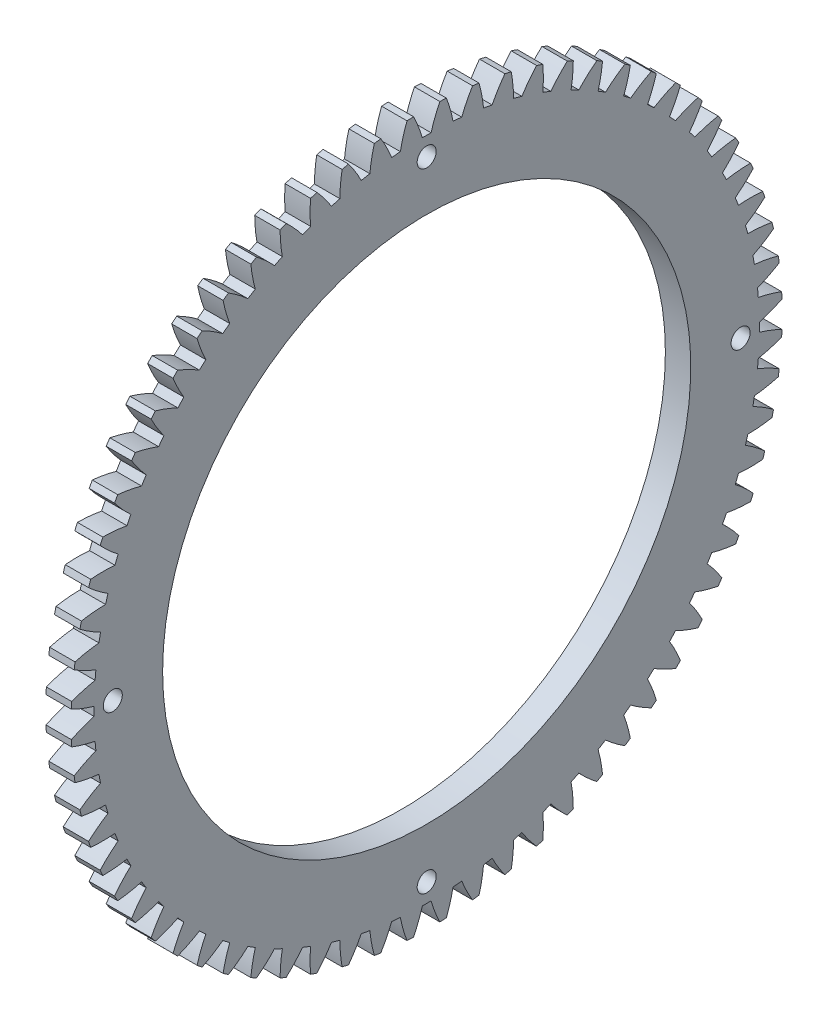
SolidWorks part; units mm, degrees
ref_plane "Plane1" through (0, 0, 0) normal (0, 0, 1) x (1, 0, 0)
ref_plane "Plane2" through (0, 0, 0) normal (0, 1, 0) x (1, 0, 0)
ref_plane "Plane3" through (0, 0, 0) normal (1, 0, 0) x (0, 0, -1)
sketch "HoldingSke" plane through (0, 0, 0) normal (0, 1, 0) x (1, 0, 0)
  line L0 (0, 0) -> (95.1501, -235.5047)
  line L1 (-15, 0) -> (100, 0) construction
  line L2 (0, 0) -> (-2.1039, 2.3779)
  line L3 (0, 0) -> (-11.863, 4.5341)
  line L4 (0, 0) -> (3.2351, 8.0072)
  line L5 (0, 0) -> (-47.5972, -17.7524)
  line L6 (0, 0) -> (-5.2639, -3.5516)
  line L7 (-2.1039, 2.3779) -> (8.8308, 51.9871)
  line L8 (-76.2, 54.61) -> (92.964, 54.61)
  line L9 (-71.009, 38.7566) -> (-53.1078, 45.2721)
  line L10 (-76.2, 71.12) -> (104.1128, 71.12)
  line L11 (0, 0) -> (-6.35, 0)
  line L12 (-76.2, 101.6) -> (-76.0984, 101.6)
  line L13 (24.9733, 27.94) -> (52.9518, 28.4284)
  line L14 (24.9733, 27.94) -> (24.9746, 27.94)
  line L15 (24.9733, 27.94) -> (100.4006, 29.5858)
  circle A0 centre (0, 0) radius 76.2
  circle A1 centre (0, 0) radius 38.1
  circle A2 centre (0, 0) radius 38.1
  circle A3 centre (0, 0) radius 76.2
sketch "BasProSke" plane through (0, 0, 0) normal (0, 1, 0) x (1, 0, 0)
  line L0 (-10, 0) -> (60, 0) construction
  line L1 (0, 0) -> (0, 88.9)
  line L2 (0, 0) -> (6.35, 0)
  line L3 (6.35, 0) -> (6.35, 88.9)
  line L4 (6.35, 88.9) -> (0, 88.9)
revolve "Base-Revolve" add sketch "BasProSke" angle 360 about L0
sketch "TooCutSke" plane through (0, 0, 0) normal (1, 0, 0) x (0, 0, -1)
  line L1 (0, 0) -> (0, 107) construction
  line L2 (0, 0) -> (-2.1725, 86.3327) construction
  line L3 (0, 0) -> (-7.975, 172.4975) construction
  line L4 (-2.1725, 86.3327) -> (-3.9875, 86.2488) construction
  arc A0 (1.0901, 83.1766) -> (-1.0901, 83.1766) centre (0, 0) ccw
  arc A1 (3.2994, 88.8642) -> (-3.2994, 88.8642) centre (0, 0) ccw
  circle A2 centre (0, 0) radius 86.36 construction
  circle A3 centre (0, 0) radius 81.1519 construction
  arc A4 (-1.0901, 83.1766) -> (-3.2994, 88.8642) centre (-34.2689, 73.5613) ccw
  arc A5 (3.2994, 88.8642) -> (1.0901, 83.1766) centre (34.2689, 73.5613) ccw
extrude "ToothCut" cut sketch "TooCutSke" along normal through all
fillet "Breaks" [suppressed] radius 0.0508
fillet "RootFillets" [suppressed] radius 0.6363
pattern_circular "TeethCuts" count 68 every 5.294 about axis through (-10, 0, 0) along (1, 0, 0) of "ToothCut", "RootFillets", "Breaks"
sketch "HubNeaOneSke" plane through (0, 0, 0) normal (-1, 0, 0) x (0, 0, 1)
  circle A0 centre (0, 0) radius 38.1
extrude "HubNearOne" [suppressed] add sketch "HubNeaOneSke" along normal blind 44.4501
sketch "HubNeaBotSke" plane through (0, 0, 0) normal (-1, 0, 0) x (0, 0, 1)
  circle A0 centre (0, 0) radius 38.1
extrude "HubNearBoth" [suppressed] add sketch "HubNeaBotSke" along normal blind 22.225
ref_plane "FarPln" through (6.35, 0, 0) normal (1, 0, 0) x (0, 0, -1)
sketch "HubFarSke" plane through (6.35, 0, 0) normal (1, 0, 0) x (0, 0, -1)
  circle A0 centre (0, 0) radius 38.1
extrude "HubFar" [suppressed] add sketch "HubFarSke" along normal blind 22.225
sketch "BorSke" plane through (0, 0, 0) normal (1, 0, 0) x (0, 0, -1)
  circle A0 centre (0, 0) radius 66.04
  dimension "D1" = 132.08
extrude "Bore" cut sketch "BorSke" along normal mid plane 101.6001
sketch "KeySke" plane through (0, 0, 0) normal (1, 0, 0) x (0, 0, -1)
  line L0 (-19.05, 0) -> (-19.05, 92.964)
  line L1 (-19.05, 92.964) -> (19.05, 92.964)
  line L2 (19.05, 92.964) -> (19.05, 0)
  line L3 (0, 0) -> (0, 34) construction
  line L4 (-19.05, 0) -> (19.05, 0)
extrude "Keyway" [suppressed] cut sketch "KeySke" along normal mid plane 101.6001
pattern_circular "Keyway2" [suppressed] count 2 every 90 about axis through (-10, 0, 0) along (1, 0, 0)
sketch "Sketch2" plane through (6.35, 0, 0) normal (1, 0, 0) x (0, 0, -1)
  line L0 (0, 78.5) -> (0, 0) construction
  line L7 (78.5, 0) -> (0, 0) construction
  circle A0 centre (0, 0) radius 85.5 construction
  circle A1 centre (0, 78.5) radius 2.3812
  circle A2 centre (78.5, 0) radius 2.3813
  circle A3 centre (0, -78.5) radius 2.3813
  circle A4 centre (-78.5, 0) radius 2.3813
  point P3 (6.9506, -0.2673)
  point P4 (0, 0)
  point P5 (0, 0)
  point P18 (0, 0)
  dimension "D1" = 171
  dimension "D4" = 4.7625
  dimension "D5" = 78.5
  dimension "D6" = 4
extrude "Cut-Extrude1" cut sketch "Sketch2" against normal through all contours A4 | A3 | A2 | A1
equation "' \"Pitch@HoldingSke\" = 4"
equation "' \"Num_teeth@HoldingSke\" = 12"
equation "' \"Ap@HoldingSke\" =  20"
equation "' \"Ap@HoldingSke\" = 20"
equation "' \"Width@HoldingSke\" = 0.5"
equation "' \"Hub_dia@HoldingSke\"= 1"
equation "' \"Hub_dia@HoldingSke\" = 1"
equation "' \"Overall_len@HoldingSke\" = 1.0"
equation "' \"Bore@HoldingSke\" = 0.75"
equation "' \"T_dim@HoldingSke\" = 0.85"
equation "' \"Width@KeySke\" = 0.25"
equation "' \"Show_teeth@HoldingSke\" = 13"
equation "' \"Backlash@HoldingSke\" = 0.009"
equation "' \"Addendum_fac@HoldingSke\" = 1.0"
equation "' \"Dedendum_fac@HoldingSke\" = 1.25"
equation "' \"Dedendum_add@HoldingSke\" = 0.00005"
equation "' \"Clearance_fac@HoldingSke\" = 0.25"
equation "' \"Pitch@HoldingSke\" = 0.5"
equation "' \"Num_teeth@HoldingSke\" = 23"
equation "' \"Show_teeth@HoldingSke\" = 23"
equation "' \"Backlash@HoldingSke\" = 0.0375"
equation "\"Overcut_dia@TooCutSke\" = (\"Num_teeth@HoldingSke\" + 2 * \"Addendum_fac@HoldingSke\") / \"Pitch@HoldingSke\" + 0.002"
equation "\"Pitch_dia@TooCutSke\" = \"Num_teeth@HoldingSke\" / \"Pitch@HoldingSke\""
equation "\"Base_dia@TooCutSke\" = \"Num_teeth@HoldingSke\" / \"Pitch@HoldingSke\" * cos((\"Ap@HoldingSke\"  * 3.14159265 / 180))"
equation "\"Root_dia@TooCutSke\" = (\"Num_teeth@HoldingSke\" + 2) / \"Pitch@HoldingSke\" - 2 * (\"Addendum_fac@HoldingSke\" + \"Dedendum_fac@HoldingSke\") / \"Pitch@HoldingSke\" - \"Dedendum_add@HoldingSke\" * 2"
equation "\"Half_ang@TooCutSke\" = 180 / \"Num_teeth@HoldingSke\""
equation "\"Half_CT@TooCutSke\" = \"Num_teeth@HoldingSke\" / \"Pitch@HoldingSke\" * sin((3.14159265 / 2 / \"Num_teeth@HoldingSke\")) / 2 - 7 * \"Backlash@HoldingSke\" / 4"
equation "\"Flank_rad@TooCutSke\" = \"Num_teeth@HoldingSke\" / \"Pitch@HoldingSke\" / 5"
equation "\"Radius@RootFillets\" = \"Clearance_fac@HoldingSke\" / \"Pitch@HoldingSke\" + \"Dedendum_add@HoldingSke\""
equation "\"Break_rad@Breaks\" = 0.02 / \"Pitch@HoldingSke\""
equation "\"Thickness@HoldingSke\" = \"Width@HoldingSke\""
equation "\"OAL@HoldingSke\" = \"Thickness@HoldingSke\""
equation "\"MHD@HoldingSke\" = (\"Num_teeth@HoldingSke\" + 2) / \"Pitch@HoldingSke\" - 2 * (\"Addendum_fac@HoldingSke\" + \"Dedendum_fac@HoldingSke\")  / \"Pitch@HoldingSke\" - \"Dedendum_add@HoldingSke\" * 2"
equation "\"MBD@HoldingSke\" = (\"Num_teeth@HoldingSke\" + 2) / \"Pitch@HoldingSke\" - 2 * (\"Addendum_fac@HoldingSke\" + \"Dedendum_fac@HoldingSke\")  / \"Pitch@HoldingSke\" - \"Dedendum_add@HoldingSke\" * 2 - 0.002"
equation "\"MHD@HoldingSke\" = ((sgn( \"MHD@HoldingSke\" - \"Hub_dia@HoldingSke\" )-1)*( \"MHD@HoldingSke\" - \"Hub_dia@HoldingSke\" ))/-2+ \"Hub_dia@HoldingSke\""
equation "\"MBD@HoldingSke\" = ((sgn( \"MBD@HoldingSke\" - \"Bore@HoldingSke\" )-1)*( \"MBD@HoldingSke\" - \"Bore@HoldingSke\" ))/-2+ \"Bore@HoldingSke\""
equation "\"OAL@HoldingSke\" = ((sgn( \"OAL@HoldingSke\" - \"Overall_len@HoldingSke\" )+1)*( \"OAL@HoldingSke\" - \"Overall_len@HoldingSke\" ))/2 + \"Overall_len@HoldingSke\" + 0.000002"
equation "\"Num_teeth@TeethCuts\" = int( \"Show_teeth@HoldingSke\" ) + 1"
equation "\"Num_teeth@TeethCuts\" = ((sgn( \"Num_teeth@TeethCuts\" - \"Num_teeth@HoldingSke\" )-1)*( \"Num_teeth@TeethCuts\" - \"Num_teeth@HoldingSke\" ))/-2+ \"Num_teeth@HoldingSke\""
equation "\"Num_teeth@TeethCuts\" = ((sgn( \"Num_teeth@TeethCuts\" - 2.0)+1)*( \"Num_teeth@TeethCuts\" - 2.0))/2 +2.0"
equation "\"Angle@TeethCuts\" = 360.0 / \"Num_teeth@HoldingSke\""
equation "\"Diameter@BasProSke\" = (\"Num_teeth@HoldingSke\" + 2 * \"Addendum_fac@HoldingSke\") / \"Pitch@HoldingSke\""
equation "\"Thickness@BasProSke\"  = \"Thickness@HoldingSke\""
equation "' \"Fillet_rad@BasProSke\" =  \"Thickness@HoldingSke\" * 0.05"
equation "' \"Fillet_rad@BasProSke\" = \"Thickness@HoldingSke\" * 0.05"
equation "\"MHD@HoldingSke\" = ((sgn( \"MHD@HoldingSke\" - \"Root_dia@TooCutSke\" )-1)*( \"MHD@HoldingSke\" - \"Root_dia@TooCutSke\" ))/-2+ \"Root_dia@TooCutSke\""
equation "\"Diameter@HubNeaOneSke\" = \"MHD@HoldingSke\""
equation "\"Length@HubNearOne\" = \"OAL@HoldingSke\" - \"Thickness@BasProSke\""
equation "\"Diameter@HubNeaBotSke\" = \"MHD@HoldingSke\""
equation "\"Length@HubNearBoth\" = ( \"OAL@HoldingSke\" - \"Thickness@BasProSke\" ) / 2.0"
equation "\"Thickness@FarPln\" = \"Thickness@BasProSke\""
equation "\"Diameter@HubFarSke\" = \"MHD@HoldingSke\""
equation "\"Length@HubFar\" = ( \"OAL@HoldingSke\" - \"Thickness@BasProSke\" ) / 2.0"
equation "\"D1@Bore\" = \"OAL@HoldingSke\" * 2.0"
equation "\"D1@Keyway\" = \"OAL@HoldingSke\" * 2.0"
equation "\"Offset@KeySke\" = \"T_dim@HoldingSke\" - \"MBD@HoldingSke\" / 2.0"
